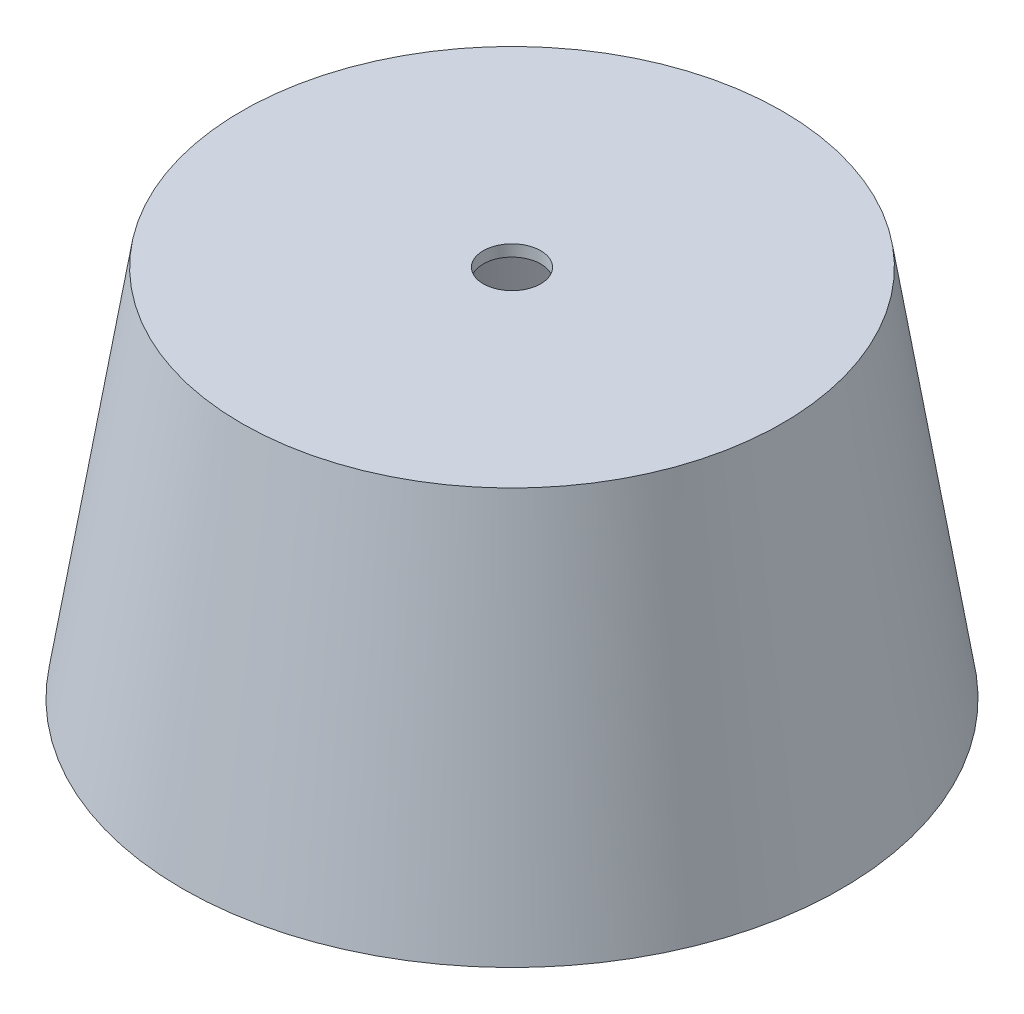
SolidWorks part; units mm, degrees
ref_plane "Alzado" through (0, 0, 0) normal (0, 0, 1) x (1, 0, 0)
ref_plane "Planta" through (0, 0, 0) normal (0, 1, 0) x (1, 0, 0)
ref_plane "Vista lateral" through (0, 0, 0) normal (1, 0, 0) x (0, 0, -1)
imported_body "SPOT MODEL 2-1-solid4"
sketch "Croquis1" plane through (0, 2.5242, 0) normal (0, -1, 0) x (1, 0, 0)
  circle A0 centre (-6.6287, 110.7768) radius 5
extrude "Cortar-Extruir1" cut sketch "Croquis1" against normal blind 10
